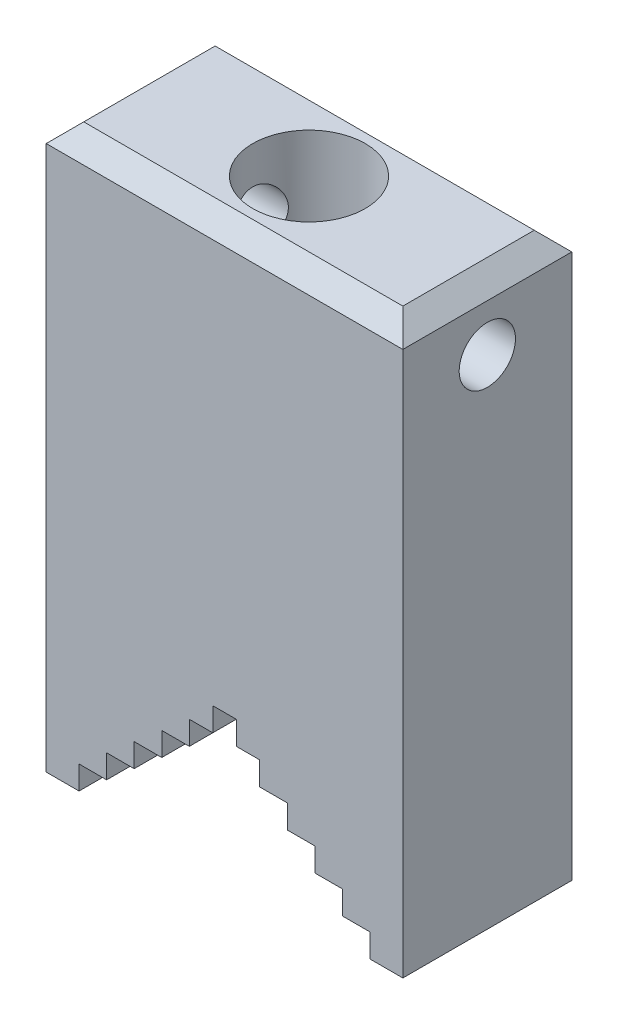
SolidWorks part; units mm, degrees
ref_plane "Front" through (0, 0, 0) normal (0, 0, 1) x (1, 0, 0)
ref_plane "Top" through (0, 0, 0) normal (0, 1, 0) x (1, 0, 0)
ref_plane "Right" through (0, 0, 0) normal (1, 0, 0) x (0, 0, -1)
sketch "Sketch1" plane through (0, 0, 0) normal (0, 0, 1) x (1, 0, 0)
  line L0 (19, -30) -> (-19, 30) construction
  line L1 (-19, 30) -> (19, 30)
  line L2 (-19, 30) -> (-19, -30)
  line L3 (-19, -30) -> (-15.5, -30)
  line L4 (19, 30) -> (19, -30)
  line L5 (0, 4.2016) -> (0, -34.1199) construction
  line L6 (-15.5, -30) -> (-15.5, -27.5)
  line L7 (-15.5, -27.5) -> (-12.5625, -27.5)
  line L8 (-12.5625, -27.5) -> (-12.5625, -25)
  line L9 (-12.5625, -25) -> (-9.625, -25)
  line L10 (-9.625, -25) -> (-9.625, -22.5)
  line L11 (-9.625, -22.5) -> (-6.6875, -22.5)
  line L12 (-6.6875, -22.5) -> (-6.6875, -20)
  line L13 (-6.6875, -20) -> (-3.75, -20)
  line L14 (-3.75, -20) -> (-3.75, -17.5)
  line L15 (-3.75, -17.5) -> (-1.25, -17.5)
  line L16 (-1.25, -17.5) -> (-1.25, -15)
  line L17 (-1.25, -15) -> (1.25, -15)
  line L18 (1.25, -17.5) -> (1.25, -15)
  line L19 (3.75, -17.5) -> (1.25, -17.5)
  line L20 (3.75, -20) -> (3.75, -17.5)
  line L21 (6.6875, -20) -> (3.75, -20)
  line L22 (6.6875, -22.5) -> (6.6875, -20)
  line L23 (9.625, -22.5) -> (6.6875, -22.5)
  line L24 (9.625, -25) -> (9.625, -22.5)
  line L25 (12.5625, -25) -> (9.625, -25)
  line L26 (12.5625, -27.5) -> (12.5625, -25)
  line L27 (15.5, -27.5) -> (12.5625, -27.5)
  line L28 (15.5, -30) -> (15.5, -27.5)
  line L29 (15.5, -30) -> (19, -30)
  point P20 (0, -15)
  dimension "D1" = 38
  dimension "D2" = 60
  dimension "D3" = 2.5
  dimension "D4" = 2.5
  dimension "D5" = 3.5
extrude "Extrude1" add sketch "Sketch1" along normal mid plane 18
sketch "Sketch2" plane through (19, 0, 0) normal (1, 0, 0) x (0, 0, -1)
  line L0 (9, -30) -> (9, 30) construction
  line L2 (-9, 30) -> (9, 30) construction
  point P0 (0, 23)
  dimension "D1" = 9
  dimension "D2" = 7
other "Hole1"
sketch "Sketch3" plane through (19, 0, 0) normal (1, 0, 0) x (0, 0, -1)
  circle A0 centre (0, 23) radius 3
  dimension "D1" = 6
sketch "Sketch4" plane through (0, 0, 0) normal (0, 0, 1) x (1, 0, 0)
  line L0 (0, 0) -> (0, 34.7467) construction
  line L1 (6, 30) -> (6, 10)
  line L2 (19, 30) -> (-19, 30) construction
  line L3 (6, 10) -> (0, 6.5359)
  line L4 (0, 6.5359) -> (0, 30)
  line L5 (0, 30) -> (6, 30)
  dimension "D1" = 12
  dimension "D2" = 60
  dimension "D4" = 20
revolve "Cut-Revolve1" cut sketch "Sketch4" angle 360 about L0
chamfer "Chamfer1" distance 2 angle 45 4 edges at (19, 30, 0) (0, 30, 9) (-19, 30, 0) (0, 30, -9)
